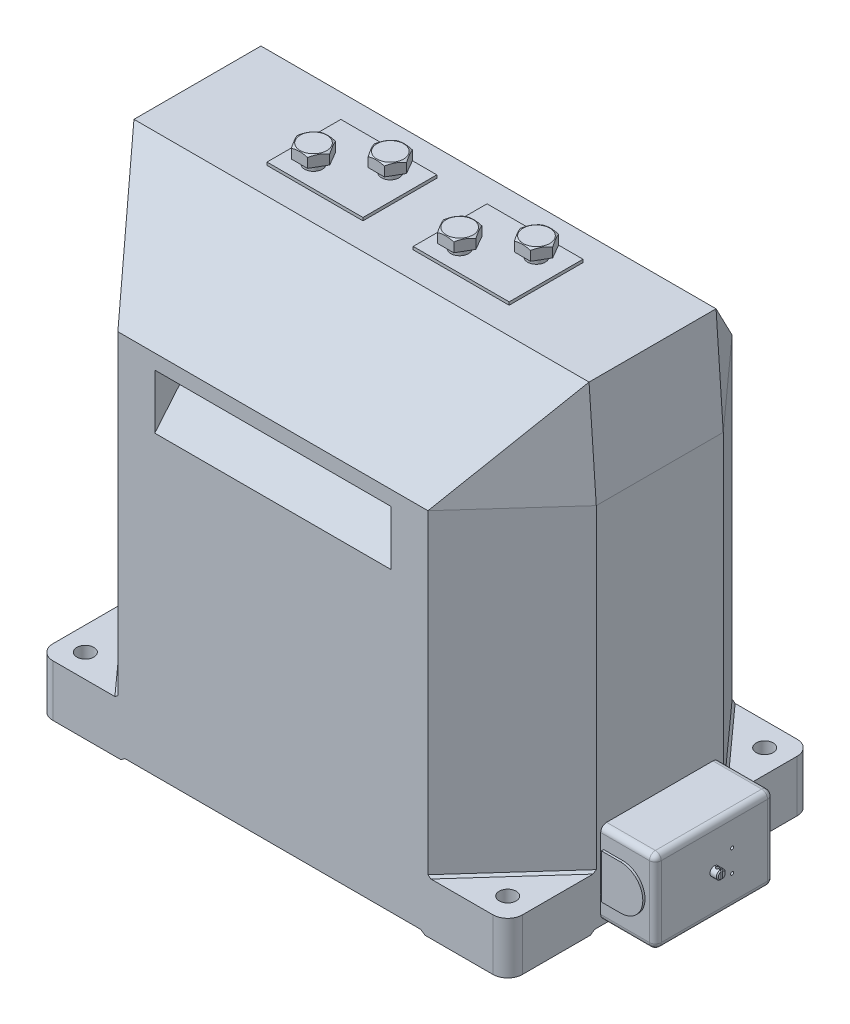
SolidWorks part; units mm, degrees
ref_plane "Front Plane" through (0, 0, 0) normal (0, 0, 1) x (1, 0, 0)
ref_plane "Top Plane" through (0, 0, 0) normal (0, 1, 0) x (1, 0, 0)
ref_plane "Right Plane" through (0, 0, 0) normal (1, 0, 0) x (0, 0, -1)
other "Join1"
other "HlTmCsDIN933<1>@24305_AM-40a_Körvonalrajzhoz"
other "HlTmCsDIN933<5>@24305_AM-40a_Körvonalrajzhoz"
other "HlTmCsDIN933<3>@24305_AM-40a_Körvonalrajzhoz"
other "HlTmCsDIN933<4>@24305_AM-40a_Körvonalrajzhoz"
other "HlTmCsDIN933<2>@24305_AM-40a_Körvonalrajzhoz"
other "FME12_TRA_Kapocsfedél_29519_113<1>@24305_AM-40a_Körvonalrajzhoz"
other "AM40a_TRA_Kiöntött_Körvonalrajzhoz<1>@24305_AM-40a_Körvonalrajzhoz/AM40a_TRA_Test_T24305<1>@AM40a_TRA_Kiöntött_Körvonalrajzhoz"
other "FME12_Tömszelence_29519_112<1>@24305_AM-40a_Körvonalrajzhoz"
other "21105-115_PlombaCsavar<1>@24305_AM-40a_Körvonalrajzhoz"
other "FME12_Tömszelence_29519_112<2>@24305_AM-40a_Körvonalrajzhoz"
